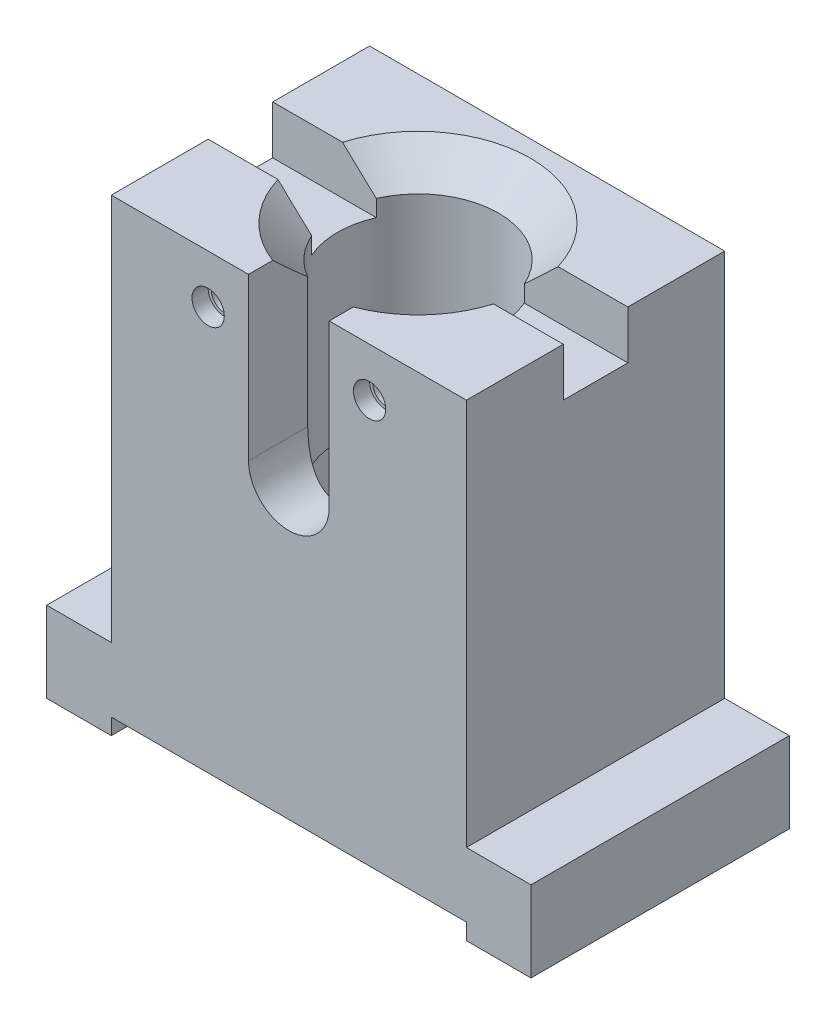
SolidWorks part; units mm, degrees
ref_plane "前视基准面" through (0, 0, 0) normal (0, 0, 1) x (1, 0, 0)
ref_plane "上视基准面" through (0, 0, 0) normal (0, 1, 0) x (1, 0, 0)
ref_plane "右视基准面" through (0, 0, 0) normal (1, 0, 0) x (0, 0, -1)
sketch "草图1" plane through (0, 0, 0) normal (0, 0, 1) x (1, 0, 0)
  line L0 (0, 0) -> (0, 86.7103) construction
  line L1 (0, 86.7103) -> (0, 0) construction
  line L2 (0, 0) -> (105.1764, 0) construction
  line L3 (11, 0) -> (-11, 0)
  line L4 (-11, 0) -> (-11, -1)
  line L5 (-11, -1) -> (-15, -1)
  line L6 (-15, -1) -> (-15, 4)
  line L7 (-15, 4) -> (-11, 4)
  line L8 (-11, 4) -> (-11, 28)
  line L9 (-11, 28) -> (11, 28)
  line L10 (11, 4) -> (11, 28)
  line L11 (15, 4) -> (11, 4)
  line L12 (15, -1) -> (15, 4)
  line L13 (11, -1) -> (15, -1)
  line L14 (11, 0) -> (11, -1)
  point P12 (0, 28)
  dimension "D1" = 28
extrude "拉伸1" add sketch "草图1" along normal mid plane 16
sketch "草图2" plane through (0, 0, 0) normal (0, 0, 1) x (1, 0, 0)
  line L0 (0, 0) -> (0, 43.4547) construction
  line L1 (0, 3.7302) -> (6, 3.7302)
  line L2 (6, 3.7302) -> (6, 13.7302)
  line L3 (6, 13.7302) -> (5, 13.7302)
  line L4 (5, 13.7302) -> (5, 26.0321)
  line L5 (5, 26.0321) -> (6.9679, 28)
  line L6 (11, 28) -> (-11, 28) construction
  line L7 (6.9679, 28) -> (0, 28)
  line L8 (0, 28) -> (0, 3.7302)
  dimension "D1" = 5
revolve "切除-旋转1" cut sketch "草图2" angle 360 about L8
sketch "草图3" plane through (-11, 0, 0) normal (-1, 0, 0) x (0, 0, 1)
  line L0 (0, 0) -> (0, 43.4547) construction
  line L1 (8, 28) -> (-8, 28) construction
  line L2 (-2, 28) -> (2, 28)
  line L3 (-2, 28) -> (-2, 25)
  line L4 (-2, 25) -> (2, 25)
  line L5 (2, 28) -> (2, 25)
extrude "切除-拉伸1" cut sketch "草图3" against normal through all
hole_wizard "M3 螺纹孔1" positions "3D草图1" profile "草图5" tap size "M3" standard "ISO"
sketch3d "3D草图1"
  line L0 (0, 3.7302, 0) -> (0, 13.7302, 0) construction
  point P0 (0, 0, 0)
  point P4 (0, 3.7302, 0)
sketch "草图5" plane through (0, 3.7302, 0) normal (1, 0, 0) x (0, 0, 1)
  line L0 (0, 0) -> (0, 3.7312)
  line L1 (0, 3.7312) -> (1.5, 3.7312)
  line L2 (1.5, 3.7312) -> (1.5, 0)
  line L5 (1.5, 0) -> (0, 0)
  line L11 (0, -6.35) -> (0, 107.95) construction
  dimension "蹟恇盄翋眻噤" = 3
  dimension "籵謂蹟恇謂郰芛旮僅" = 3.7312
hole_wizard "M2 螺纹孔1" positions "3D草图2" profile "草图7" tap size "M2" standard "ISO"
sketch3d "3D草图2"
  point P0 (-5, 25, 8)
  point P2 (5, 25, 8)
sketch "草图7" plane through (-5, 25, 8) normal (1, 0, 0) x (0, -1, 0)
  line L0 (0, 0) -> (0, 2.4807)
  line L1 (0, 2.4807) -> (0.8, 2)
  line L2 (0.8, 2) -> (0.8, 1)
  line L3 (0.8, 1) -> (1, 1)
  line L4 (1, 1) -> (1, 0)
  line L5 (1, 0) -> (0, 0)
  line L10 (0, 2.4807) -> (-0.8, 2) construction
  line L11 (0, -6.35) -> (0, 107.95) construction
  dimension "蹟恇謂郰芛眻噤" = 1.6
  dimension "蹟恇謂郰芛旮僅" = 2
  dimension "蹟恇翋眻噤" = 2
  dimension "蹟恇旮僅" = 1
  dimension "絳芛褒僅" = 118
sketch "草图8" plane through (0, 0, 8) normal (0, 0, 1) x (1, 0, 0)
  line L0 (-2.5, 18) -> (-2.5, 28)
  line L1 (11, 28) -> (-11, 28) construction
  line L2 (2.5, 18) -> (2.5, 28)
  line L3 (2.5, 28) -> (-2.5, 28)
  arc A0 (-2.5, 18) -> (2.5, 18) centre (0, 18) ccw
  dimension "D1" = 10
extrude "切除-拉伸2" cut sketch "草图8" against normal up to next
